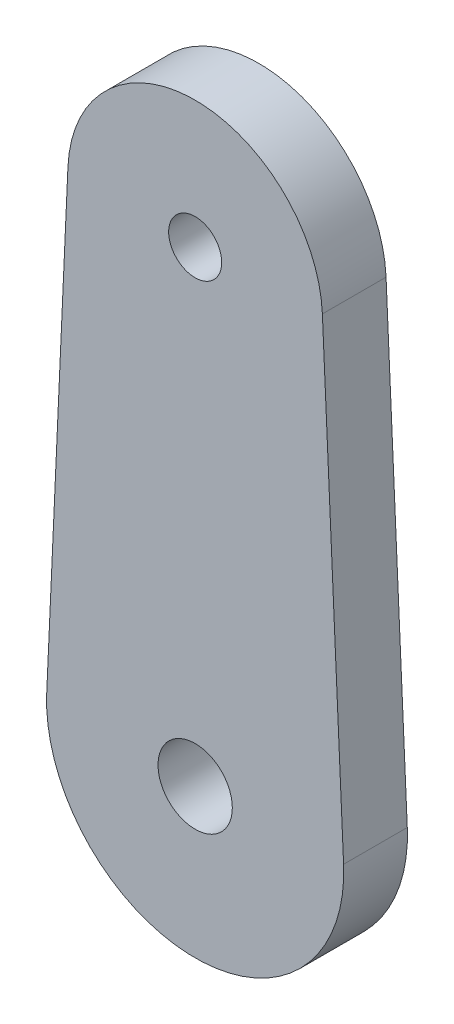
SolidWorks part; units mm, degrees
ref_plane "Front Plane" through (0, 0, 0) normal (0, 0, 1) x (1, 0, 0)
ref_plane "Top Plane" through (0, 0, 0) normal (0, 1, 0) x (1, 0, 0)
ref_plane "Right Plane" through (0, 0, 0) normal (1, 0, 0) x (0, 0, -1)
sketch "Sketch1" plane through (0, 0, 0) normal (0, 0, 1) x (1, 0, 0)
  line L0 (0, 0) -> (0, 22) construction
  line L1 (-5.9938, 22.2727) -> (-6.9928, 0.3182)
  line L2 (5.9938, 22.2727) -> (6.9928, 0.3182)
  circle A0 centre (0, 0) radius 1.75
  arc A1 (-6.9928, 0.3182) -> (6.9928, 0.3182) centre (0, 0) ccw
  arc A3 (5.9938, 22.2727) -> (-5.9938, 22.2727) centre (0, 22) ccw
  dimension "D2" = 3.5
  dimension "D3" = 12
  dimension "D4" = 14
  dimension "D1" = 22
extrude "Extrude1" add sketch "Sketch1" along normal blind 3
hole_wizard "M3 Tapped Hole1" positions "3DSketch1" profile "Sketch2" tap size "M3" standard "ISO"
sketch3d "3DSketch1"
  line L0 (0, 22, 3) -> (0, 22, 0) construction
  point P0 (0, 22, 3)
sketch "Sketch2" plane through (0, 22, 3) normal (1, 0, 0) x (0, -1, 0)
  line L0 (0, 0) -> (0, 3)
  line L1 (0, 3) -> (1.25, 3)
  line L2 (1.25, 3) -> (1.25, 0)
  line L5 (1.25, 0) -> (0, 0)
  line L11 (0, -6.35) -> (0, 107.95) construction
  dimension "Thru Tap Drill Dia." = 2.5
  dimension "Thru Tap Drill Depth" = 3
